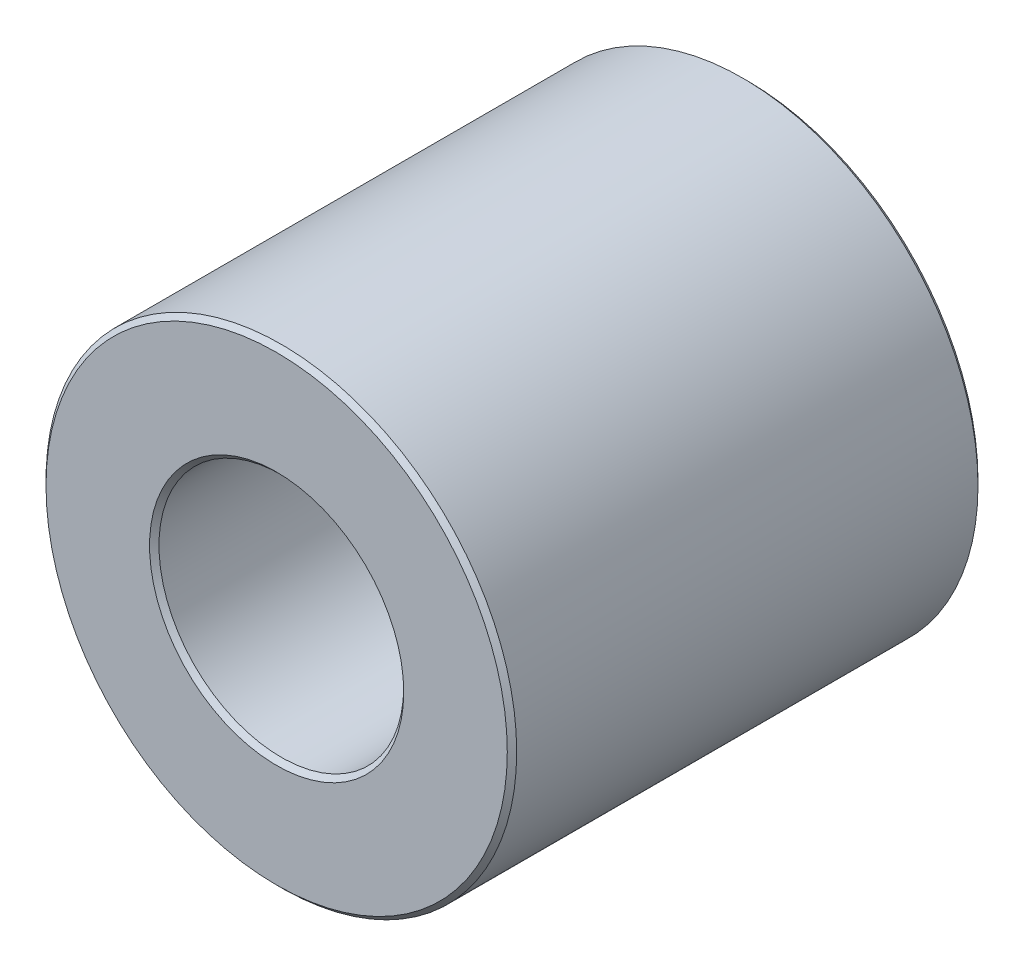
SolidWorks part; units mm, degrees
ref_plane "Front Plane" through (0, 0, 0) normal (0, 0, 1) x (1, 0, 0)
ref_plane "Top Plane" through (0, 0, 0) normal (0, 1, 0) x (1, 0, 0)
ref_plane "Right Plane" through (0, 0, 0) normal (1, 0, 0) x (0, 0, -1)
sketch "Sketch1" plane through (0, 0, 0) normal (0, 0, 1) x (1, 0, 0)
  circle A0 centre (0, 0) radius 5
  circle A1 centre (0, 0) radius 2.6
  dimension "D1" = 10
  dimension "D2" = 5.2
extrude "Boss-Extrude2" add sketch "Sketch1" along normal mid plane 10
chamfer "Chamfer3" distance 0.1 angle 45 4 edges at (5, 0, 5) (5, 0, -5) (2.6, 0, -5) (2.6, 0, 5)
